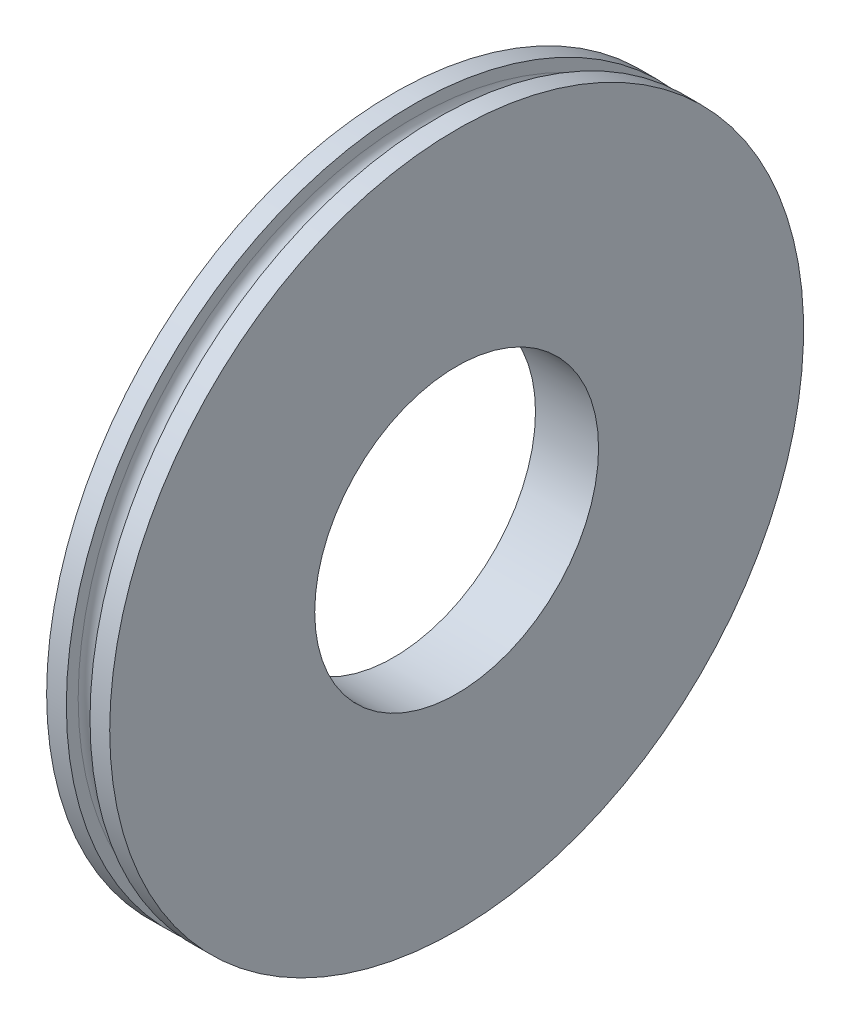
SolidWorks part; units mm, degrees
ref_plane "Front Plane" through (0, 0, 0) normal (0, 0, 1) x (1, 0, 0)
ref_plane "Top Plane" through (0, 0, 0) normal (0, 1, 0) x (1, 0, 0)
ref_plane "Right Plane" through (0, 0, 0) normal (1, 0, 0) x (0, 0, -1)
sketch "Sketch1" plane through (0, 0, 0) normal (0, 0, 1) x (1, 0, 0)
  line L1 (-3.175, 0) -> (3.175, 0)
  line L2 (-3.175, 0) -> (-3.175, 33.7344)
  line L4 (3.175, 0) -> (3.175, 33.7344)
  line L5 (0, 33.7344) -> (0, 34.642) construction
  line L7 (1.1906, 33.7344) -> (1.1906, 34.925)
  line L8 (1.1906, 34.925) -> (3.175, 34.925)
  line L9 (3.175, 33.7344) -> (3.175, 34.925)
  line L10 (-3.175, 33.7344) -> (-3.175, 34.925)
  line L11 (-1.1906, 34.925) -> (-3.175, 34.925)
  line L12 (-1.1906, 33.7344) -> (-1.1906, 34.925)
  arc A0 (-1.1906, 33.7344) -> (1.1906, 33.7344) centre (0, 33.7344) ccw
  dimension "D1" = 2.3813
  dimension "D2" = 33.7344
  dimension "D3" = 6.35
  dimension "D4" = 1.1906
revolve "Revolve1" add sketch "Sketch1" angle 360 about L1
sketch "Sketch2" plane through (3.175, 0, 0) normal (1, 0, 0) x (0, 0, -1)
  circle A0 centre (0, 0) radius 14.2875
  dimension "D1" = 28.575
extrude "Cut-Extrude1" cut sketch "Sketch2" against normal through all
